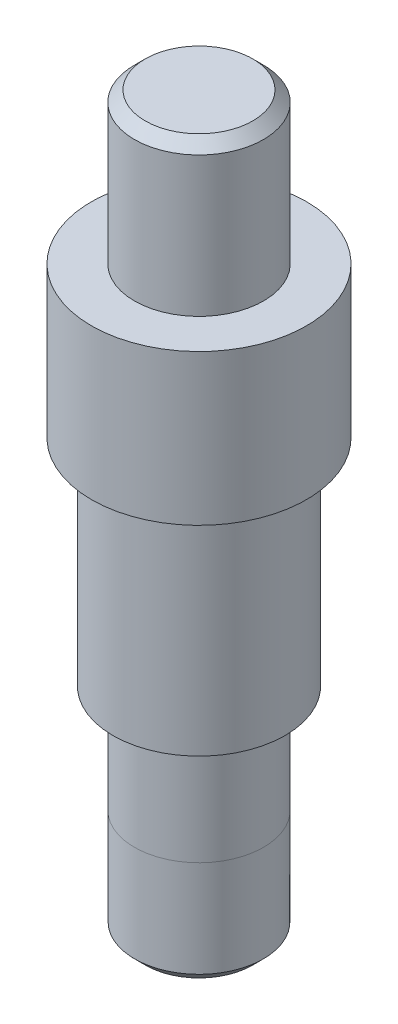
SolidWorks part; units mm, degrees
ref_plane "Front" through (0, 0, 0) normal (0, 0, 1) x (1, 0, 0)
ref_plane "Top" through (0, 0, 0) normal (0, 1, 0) x (1, 0, 0)
ref_plane "Right" through (0, 0, 0) normal (1, 0, 0) x (0, 0, -1)
sketch "Sketch1" plane through (0, 0, 0) normal (0, 1, 0) x (1, 0, 0)
  circle A0 centre (0, 0) radius 5
extrude "Extrude1" add sketch "Sketch1" along normal blind 7
sketch "Sketch2" plane through (0, 7, 0) normal (0, 1, 0) x (-1, 0, 0)
  circle A0 centre (0, 0) radius 3
extrude "Extrude2" add sketch "Sketch2" along normal blind 7
sketch "Sketch3" plane through (0, 0, 0) normal (0, -1, 0) x (1, 0, 0)
  circle A0 centre (0, 0) radius 4
extrude "Extrude3" add sketch "Sketch3" along normal blind 10
sketch "Sketch4" plane through (0, -10, 0) normal (0, -1, 0) x (1, 0, 0)
  circle A0 centre (0, 0) radius 3
extrude "Extrude4" add sketch "Sketch4" along normal blind 5
sketch "Sketch5" plane through (0, -15, 0) normal (0, -1, 0) x (1, 0, 0)
  circle A0 centre (0, 0) radius 2.99
extrude "Extrude5" add sketch "Sketch5" along normal blind 5
chamfer "Chamfer1" distance 0.5 angle 45 2 edges at (0, -20, -2.99) (0, 14, 3)
